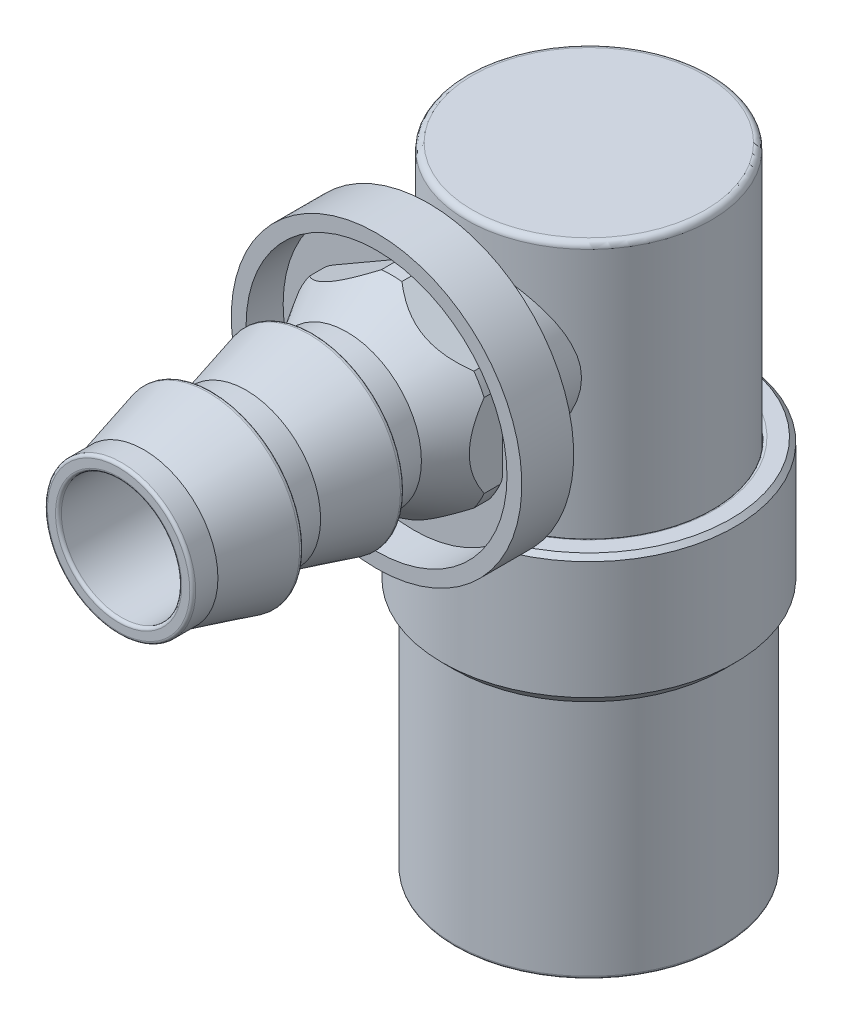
SolidWorks part; units mm, degrees
other "BODY_"
ref_plane "Front Plane" through (0, 0, 0) normal (0, 0, 1) x (1, 0, 0)
ref_plane "Top Plane" through (0, 0, 0) normal (0, 1, 0) x (1, 0, 0)
ref_plane "Right Plane" through (0, 0, 0) normal (1, 0, 0) x (0, 0, -1)
imported_body "PL-BARB"
imported_body "BARB"
imported_body "SC200S"
imported_body "BODY"
imported_body "SLEEVE"
sketch "Sketch1" plane through (0, 0, 0) normal (0, 0, 1) x (1, 0, 0)
  line L0 (-6.7437, 1.016) -> (-4.7625, 2.9972)
  line L1 (-4.7625, 2.9972) -> (-4.7625, 11.1863)
  line L2 (-4.7625, 11.1863) -> (-6.7437, 13.0794)
  line L3 (-6.7437, 13.0794) -> (-6.7437, 1.016)
  line L4 (0, 8.7926) -> (0, -2.6506) construction
  dimension "D1" = 9.525
revolve "Revolve1" add sketch "Sketch1" angle 360 about L4
sketch "Sketch2" plane through (0, 0, 0) normal (0, -1, 0) x (1, 0, 0)
  line L1 (0, 7.479) -> (-6.477, 3.7395)
  line L2 (-6.477, 3.7395) -> (-6.477, -3.7395)
  line L3 (-6.477, -3.7395) -> (0, -7.479)
  line L4 (0, -7.479) -> (6.477, -3.7395)
  line L5 (6.477, -3.7395) -> (6.477, 3.7395)
  line L6 (6.477, 3.7395) -> (0, 7.479)
  circle A0 centre (0, 0) radius 6.477 construction
  dimension "D1" = 12.954
extrude "Cut-Extrude1" cut sketch "Sketch2" against normal up to surface (15.5119 mm away)
